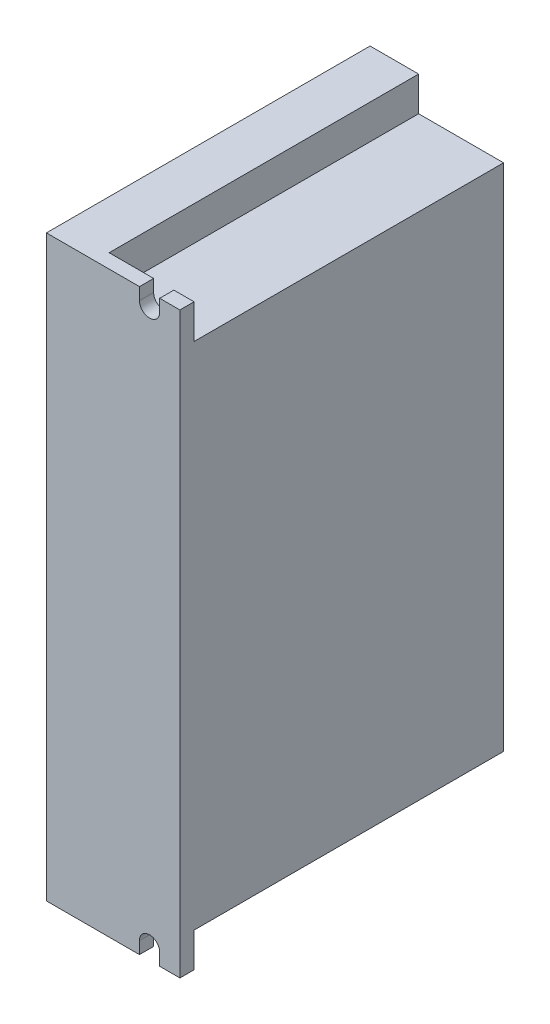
SolidWorks part; units mm, degrees
ref_plane "前视基准面" through (0, 0, 0) normal (0, 0, 1) x (1, 0, 0)
ref_plane "上视基准面" through (0, 0, 0) normal (0, 1, 0) x (1, 0, 0)
ref_plane "右视基准面" through (0, 0, 0) normal (1, 0, 0) x (0, 0, -1)
sketch "草图1" plane through (0, 0, 0) normal (1, 0, 0) x (0, 0, -1)
  line L1 (-40, -71.5) -> (40, -71.5)
  line L2 (-40, -71.5) -> (-40, 71.5)
  line L3 (-40, 71.5) -> (40, 71.5)
  line L4 (40, -71.5) -> (40, 71.5)
  line L5 (-40, -71.5) -> (40, 71.5) construction
  line L6 (-40, 71.5) -> (40, -71.5) construction
  point P0 (0, 0)
extrude "凸台-拉伸1" add sketch "草图1" along normal blind 33
sketch "草图2" plane through (33, 0, 0) normal (1, 0, 0) x (0, 0, -1)
  line L0 (-36.5, -71.5) -> (-36.5, -63)
  line L2 (-40, -71.5) -> (40, -71.5) construction
  line L3 (-36.5, 63) -> (-36.5, 71.5)
  line L4 (40, 71.5) -> (-40, 71.5) construction
  line L5 (-36.5, 71.5) -> (40, 71.5)
  line L6 (40, 71.5) -> (40, 63)
  line L7 (40, -71.5) -> (40, 71.5) construction
  line L8 (40, 63) -> (-36.5, 63)
  line L9 (-36.5, -63) -> (40, -63)
  line L10 (40, -63) -> (40, -71.5)
  line L11 (40, -71.5) -> (-36.5, -71.5)
extrude "切除-拉伸1" cut sketch "草图2" against normal blind 21
sketch "草图3" plane through (0, 0, 36.5) normal (0, 0, -1) x (-1, 0, 0)
  line L1 (-23, -68.5) -> (-23, -71.5)
  line L2 (-23, 68.5) -> (-23, 71.5)
  line L3 (-33, -71.5) -> (0, -71.5) construction
  line L5 (-23, -71.5) -> (-28, -71.5)
  line L6 (-28, -71.5) -> (-28, -68.5)
  line L9 (-23, 71.5) -> (-28, 71.5)
  line L11 (-28, 71.5) -> (-28, 68.5)
  arc A0 (-23, -68.5) -> (-28, -68.5) centre (-25.5, -68.5) ccw
  arc A2 (-28, 68.5) -> (-23, 68.5) centre (-25.5, 68.5) ccw
extrude "切除-拉伸2" cut sketch "草图3" against normal blind 3.5
